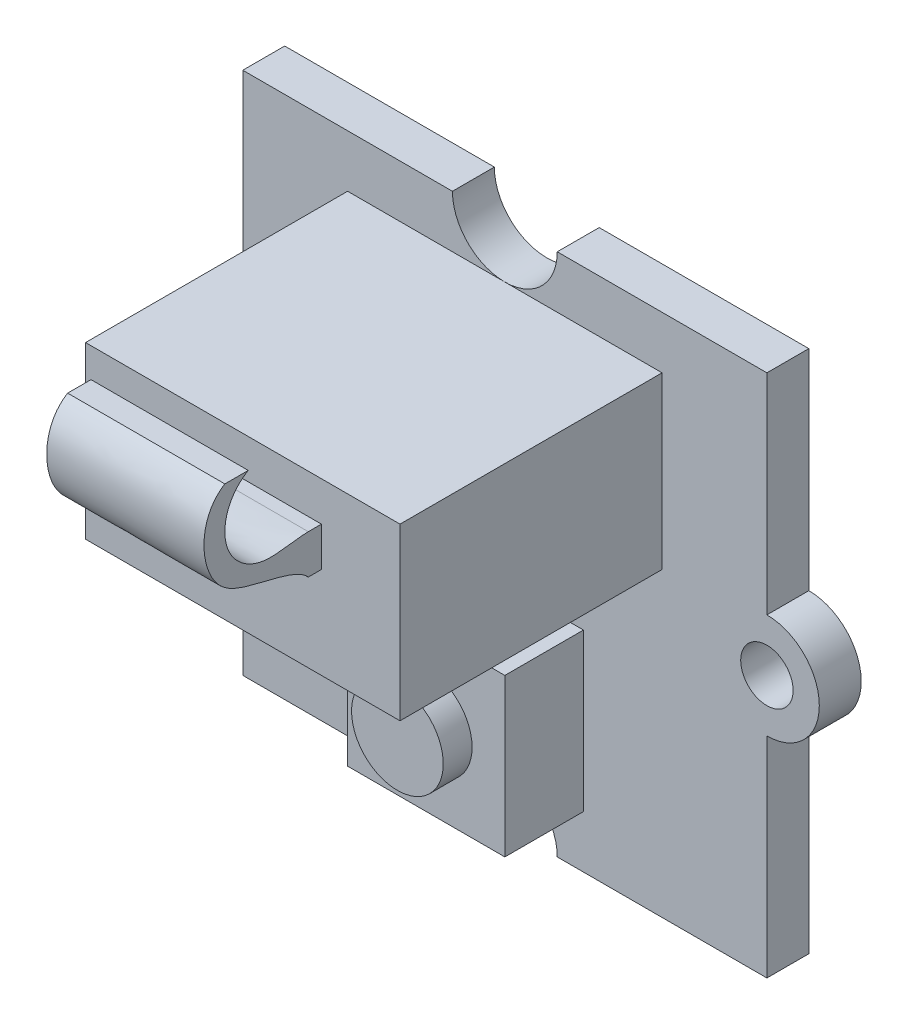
SolidWorks part; units mm, degrees
ref_plane "Plan de face" through (0, 0, 0) normal (0, 0, 1) x (1, 0, 0)
ref_plane "Plan de dessus" through (0, 0, 0) normal (0, 1, 0) x (1, 0, 0)
ref_plane "Plan de droite" through (0, 0, 0) normal (1, 0, 0) x (0, 0, -1)
sketch "Esquisse1" plane through (0, 0, 0) normal (0, 0, 1) x (1, 0, 0)
  line L0 (0, -19.2142) -> (0, 39.5757) construction
  line L1 (-10, 10) -> (-2, 10)
  line L2 (-10, 10) -> (-10, 2)
  line L3 (-10, -10) -> (-2, -10)
  line L4 (-10, -10) -> (-10, -2)
  line L5 (10, -10) -> (10, -2)
  line L6 (10, -10) -> (2, -10)
  line L7 (10, 10) -> (10, 2)
  line L8 (10, 10) -> (2, 10)
  circle A0 centre (-10, 0) radius 1
  arc A1 (-2, 10) -> (2, 10) centre (0, 10) ccw
  arc A2 (2, -10) -> (-2, -10) centre (0, -10) ccw
  arc A3 (-10, 2) -> (-10, -2) centre (-10, 0) ccw
  arc A4 (10, 2) -> (10, -2) centre (10, 0) cw
  circle A5 centre (10, 0) radius 1
  dimension "D1" = 2
  dimension "D3" = 2
  dimension "D4" = 2
  dimension "D7" = 2
  dimension "D2" = 10
  dimension "D5" = 10
  dimension "D6" = 10
extrude "Boss.-Extru.1" add sketch "Esquisse1" along normal blind 1.6
sketch "Esquisse2" plane through (0, 0, 1.6) normal (0, 0, 1) x (1, 0, 0)
  line L0 (-10, -2) -> (-10, -10) construction
  line L1 (-3, -2) -> (3, -2)
  line L2 (-3, -2) -> (-3, -8)
  line L3 (-3, -8) -> (3, -8)
  line L4 (3, -2) -> (3, -8)
  line L5 (2, -10) -> (10, -10) construction
  point P6 (6, -10)
  dimension "D1" = 6
  dimension "D2" = 6
  dimension "D3" = 7
  dimension "D4" = 2
extrude "Boss.-Extru.2" add sketch "Esquisse2" along normal blind 3
sketch "Esquisse3" plane through (0, 0, 0) normal (0, 0, -1) x (-1, 0, 0)
  line L0 (-2, -10) -> (-10, -10) construction
  circle A0 centre (0, -5) radius 1.75
  dimension "D1" = 3.5
  dimension "D2" = 5
extrude "Boss.-Extru.3" add sketch "Esquisse3" against normal blind 5.7
sketch "Esquisse4" plane through (0, 0, 1.6) normal (0, 0, 1) x (1, 0, 0)
  line L0 (-10, 10) -> (-10, 2) construction
  line L1 (-6, 8) -> (6, 8)
  line L2 (-6, 8) -> (-6, 1.5)
  line L3 (-6, 1.5) -> (6, 1.5)
  line L4 (6, 8) -> (6, 1.5)
  circle A0 centre (0, -5) radius 1.75 construction
  point P6 (-10, 6)
  dimension "D1" = 12
  dimension "D2" = 6.5
  dimension "D3" = 6.5
  dimension "D4" = 4
extrude "Boss.-Extru.4" add sketch "Esquisse4" along normal blind 10
sketch "Esquisse5" plane through (-6, 0, 0) normal (-1, 0, 0) x (0, 0, 1)
  line L0 (11.6, 6.5) -> (11.6, 5)
  line L1 (11.6, 8) -> (11.6, 1.5) construction
  line L3 (11.6, 5) -> (12.1, 5)
  line L4 (11.6, 6.5) -> (12.1, 6.5)
  line L5 (14.3919, 9.6703) -> (15.2838, 9.6703)
  spline S0 degree 3 poles (14.3919, 9.6703) (15.2833, 9.1525) (15.6343, 7.4489) (13.8708, 6.1153) (12.7481, 6.4879) (12.1, 6.5) knots 0 0 0 0 0.464497 0.667364 1 1 1 1
  spline S1 degree 3 poles (12.1, 5) (12.4778, 5.4426) (14.2366, 5.7291) (16.2071, 6.521) (16.3635, 9.0148) (15.2838, 9.6703) knots 0 0 0 0 0.287374 0.493419 1 1 1 1
  dimension "D1" = 1.5
  dimension "D2" = 5
  dimension "D3" = 0.5
  dimension "D4" = 0.5
extrude "Boss.-Extru.5" add sketch "Esquisse5" against normal blind 6 from offset 3
